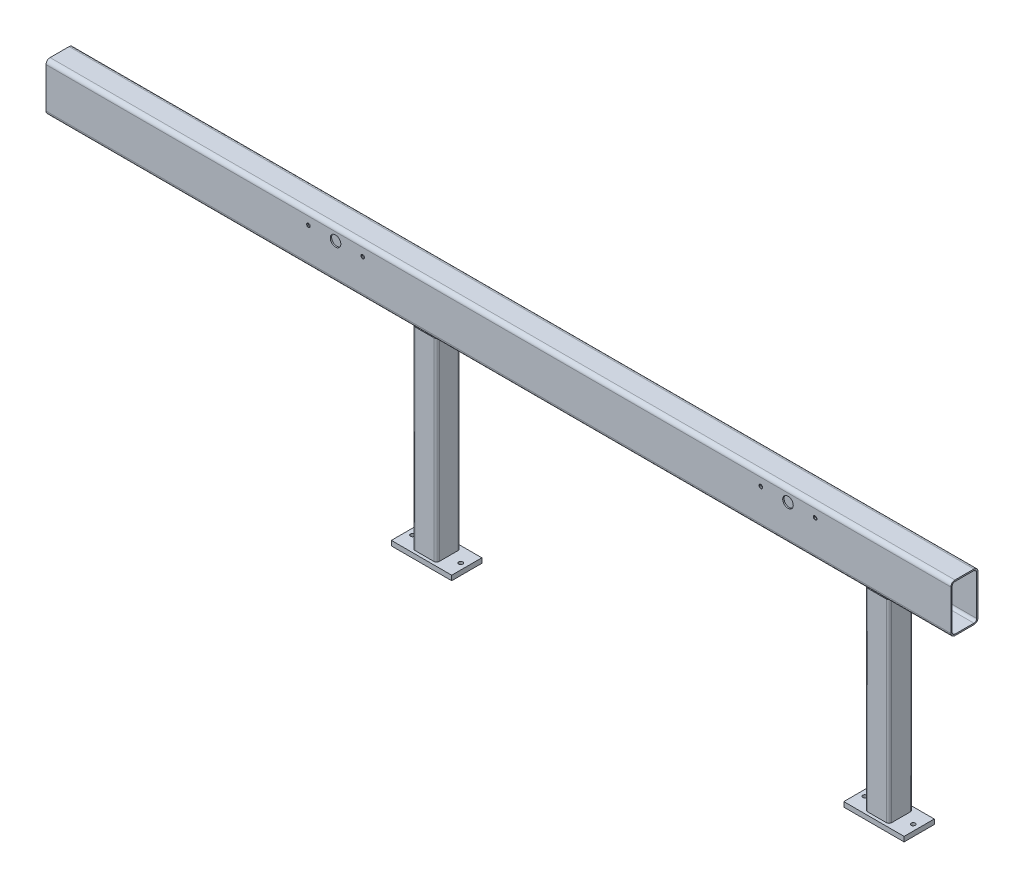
SolidWorks part; units mm, degrees
ref_plane "Ebene vorne" through (0, 0, 0) normal (0, 0, 1) x (1, 0, 0)
ref_plane "Ebene oben" through (0, 0, 0) normal (0, 1, 0) x (1, 0, 0)
ref_plane "Ebene rechts" through (0, 0, 0) normal (1, 0, 0) x (0, 0, -1)
sketch "Skizze1" plane through (0, 0, 0) normal (0, 0, 1) x (1, 0, 0)
  line L0 (-3000, 0) -> (0, 0)
  line L1 (-250, -730) -> (-250, 0)
  line L2 (-1750, 0) -> (-1750, -730)
  line L3 (-1650, -730) -> (-1850, -730)
  line L5 (-350, -730) -> (-150, -730)
  dimension "D1" = 3000
  dimension "D2" = 1500
  dimension "D3" = 730
  dimension "D4" = 250
  dimension "D5" = 200
  dimension "D6" = 200
other "Strukturbauteil1"
ref_plane "Ebene27" through (-3000, 0, 0) normal (1, 0, 0) x (0, 0, 1)
sketch "Skizze155" plane through (-3000, 0, 0) normal (1, 0, 0) x (0, 0, 1)
  line L0 (-31.5, 75.5) -> (31.5, 75.5)
  line L1 (-31.5, 80) -> (31.5, 80)
  line L2 (-45, 66.5) -> (-45, -66.5)
  line L3 (-31.5, -80) -> (31.5, -80)
  line L4 (45, 66.5) -> (45, -66.5)
  line L5 (40.5, 66.5) -> (40.5, -66.5)
  line L6 (-31.5, -75.5) -> (31.5, -75.5)
  line L7 (-40.5, 66.5) -> (-40.5, -66.5)
  line L8 (0, 80) -> (0, -80) construction
  arc A0 (-31.5, 80) -> (-45, 66.5) centre (-31.5, 66.5) ccw
  arc A1 (31.5, 80) -> (45, 66.5) centre (31.5, 66.5) cw
  arc A2 (31.5, -80) -> (45, -66.5) centre (31.5, -66.5) ccw
  arc A3 (-45, -66.5) -> (-31.5, -80) centre (-31.5, -66.5) ccw
  arc A4 (31.5, 75.5) -> (40.5, 66.5) centre (31.5, 66.5) cw
  arc A5 (31.5, -75.5) -> (40.5, -66.5) centre (31.5, -66.5) ccw
  arc A6 (-40.5, -66.5) -> (-31.5, -75.5) centre (-31.5, -66.5) ccw
  arc A7 (-31.5, 75.5) -> (-40.5, 66.5) centre (-31.5, 66.5) ccw
  point P20 (-45, 80)
  point P21 (45, 80)
  point P22 (-45, -80)
  point P23 (45, -80)
  point P25 (-45, 0)
  point P26 (45, 0)
  point P27 (0, -80)
  point P28 (0, 80)
  point P30 (0, 0)
  dimension "r" = 13.5
  dimension "a" = 160
  dimension "s" = 4.5
  dimension "b" = 90
other "Strukturbauteil2"
ref_plane "Ebene28" through (-250, -730, 0) normal (0, 1, 0) x (-1, 0, 0)
sketch "Skizze156" plane through (-250, -730, 0) normal (0, 1, 0) x (-1, 0, 0)
  line L0 (-31, 36.4) -> (31, 36.4)
  line L1 (-31, 40) -> (31, 40)
  line L2 (-40, 31) -> (-40, -31)
  line L3 (-31, -40) -> (31, -40)
  line L4 (40, 31) -> (40, -31)
  line L5 (36.4, 31) -> (36.4, -31)
  line L6 (-31, -36.4) -> (31, -36.4)
  line L7 (-36.4, 31) -> (-36.4, -31)
  line L8 (0, 40) -> (0, -40) construction
  arc A0 (-31, 40) -> (-40, 31) centre (-31, 31) ccw
  arc A1 (31, 40) -> (40, 31) centre (31, 31) cw
  arc A2 (31, -40) -> (40, -31) centre (31, -31) ccw
  arc A3 (-40, -31) -> (-31, -40) centre (-31, -31) ccw
  arc A4 (31, 36.4) -> (36.4, 31) centre (31, 31) cw
  arc A5 (31, -36.4) -> (36.4, -31) centre (31, -31) ccw
  arc A6 (-36.4, -31) -> (-31, -36.4) centre (-31, -31) ccw
  arc A7 (-31, 36.4) -> (-36.4, 31) centre (-31, 31) ccw
  point P20 (-40, 40)
  point P21 (40, 40)
  point P22 (-40, -40)
  point P23 (40, -40)
  point P25 (-40, 0)
  point P26 (40, 0)
  point P27 (0, -40)
  point P28 (0, 40)
  point P30 (0, 0)
  dimension "r" = 9
  dimension "a" = 80
  dimension "s" = 3.6
  dimension "b" = 80
other "Strukturbauteil3"
ref_plane "Ebene29" through (-350, -730, 0) normal (1, 0, 0) x (0, 0, 1)
sketch "Skizze1571" plane through (-350, -730, 0) normal (1, 0, 0) x (0, 0, 1)
  line L0 (0, 0) -> (50, 0) construction
  line L1 (0, 8) -> (0, 0) construction
  line L2 (-50, 8) -> (-50, -8)
  line L3 (50, -8) -> (-50, -8)
  line L4 (50, 8) -> (-50, 8)
  line L5 (50, 8) -> (50, -8)
  point P4 (0, 0)
  point P9 (0, -8)
  point P10 (0, 8)
  point P11 (50, 0)
  point P12 (-50, 0)
  dimension "b" = 100
  dimension "s" = 16
other "Trimmen/Verlängern1"
sketch "Skizze12" plane through (0, 0, 45) normal (0, 0, 1) x (1, 0, 0)
  line L0 (0, 66.5) -> (0, -66.5) construction
  line L6 (-3000, 0) -> (0, 0) construction
  circle A0 centre (-540, 40) radius 17.5
  dimension "D2" = 35
  dimension "D1" = 540
  dimension "D3" = 40
extrude "Schnitt-Linear austragen1" cut sketch "Skizze12" against normal through all
hole_wizard "M12 Gewindebohrung1" positions "Skizze158" profile "Skizze157" tap size "M12" standard "DIN"
sketch "Skizze158" plane through (0, 0, 45) normal (0, 0, 1) x (1, 0, 0)
  line L0 (-3000, 0) -> (0, 0) construction
  circle A1 centre (-540, 40) radius 17.5 construction
  point P0 (-450, 40)
  point P1 (-630, 40)
  dimension "D1" = 180
  dimension "D2" = 90
  dimension "D3" = 40
sketch "Skizze157" plane through (-450, 40, 45) normal (1, 0, 0) x (0, -1, 0)
  line L0 (0, 0) -> (0, 95)
  line L1 (0, 95) -> (5.1, 95)
  line L2 (5.1, 95) -> (5.1, 0.925)
  line L3 (5.1, 0.925) -> (6.025, 0)
  line L5 (6.025, 0) -> (0, 0)
  line L6 (-5.1, 0.925) -> (-6.025, 0) construction
  line L11 (0, -6.35) -> (0, 107.95) construction
  dimension "Bohrerdurchmesser" = 10.2
  dimension "Bohrungstiefe" = 95
  dimension "Senkdurchmesser (Oben)" = 12.05
  dimension "Senkwinkel (Oben)" = 90
hole_wizard "Ø13.5 (13.5) Durchmesser Bohrung1" positions "Skizze146" profile "Skizze145" hole size "Ø13.5" standard "ISO"
sketch "Skizze146" plane through (50.4473, -738, 16.8923) normal (0, -1, 0) x (1, 0, 0)
  line L0 (-380.4473, -16.8923) -> (-220.4473, -16.8923) construction
  point P0 (-380.4473, -16.8923)
  point P1 (-220.4473, -16.8923)
  dimension "D1" = 160
sketch "Skizze145" plane through (-330, -738, 0) normal (1, 0, 0) x (0, 0, -1)
  line L0 (0, 0) -> (0, 16)
  line L1 (0, 16) -> (6.75, 16)
  line L2 (6.75, 16) -> (6.75, 0)
  line L5 (6.75, 0) -> (0, 0)
  line L11 (0, -6.35) -> (0, 107.95) construction
  dimension "Bohrerdurchmesser" = 13.5
  dimension "Bohrungstiefe" = 16
pattern_linear "Lineares Muster1" count 2 spacing 1500 along (-1, 0, 0) of "Schnitt-Linear austragen1", "M12 Gewindebohrung1", "Ø13.5 (13.5) Durchmesser Bohrung1"
